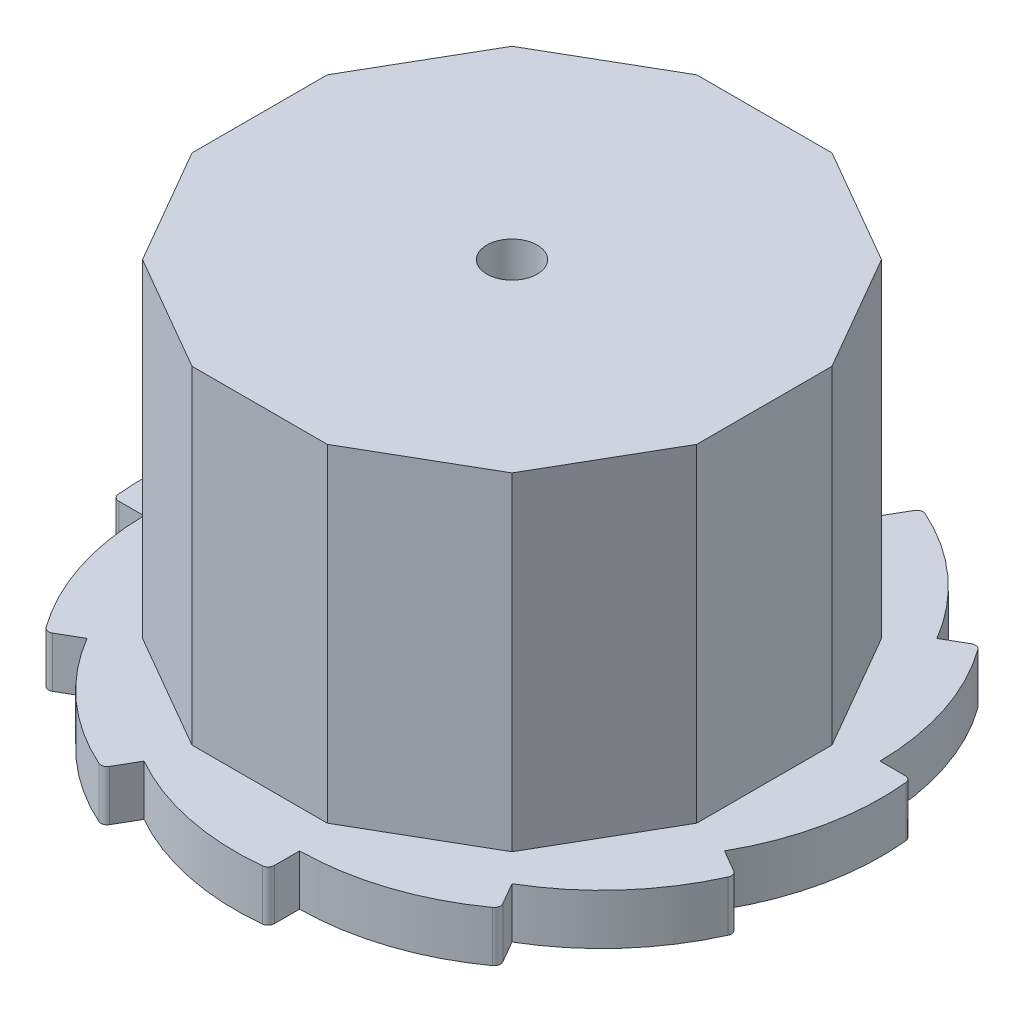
SolidWorks part; units mm, degrees
ref_plane "Front Plane" through (0, 0, 0) normal (0, 0, 1) x (1, 0, 0)
ref_plane "Top Plane" through (0, 0, 0) normal (0, 1, 0) x (1, 0, 0)
ref_plane "Right Plane" through (0, 0, 0) normal (1, 0, 0) x (0, 0, -1)
body saved out of another part "Stock-Calendar Test Model-1"
